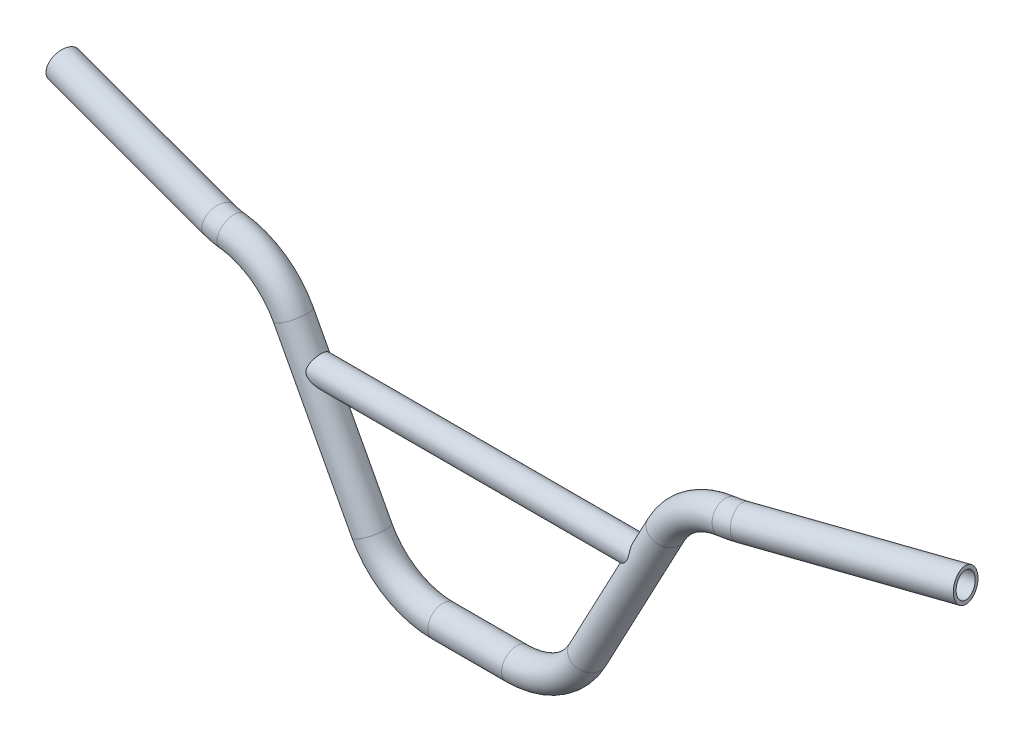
SolidWorks part; units mm, degrees
ref_plane "Plan de face" through (0, 0, 0) normal (0, 0, 1) x (1, 0, 0)
ref_plane "Plan de dessus" through (0, 0, 0) normal (0, 1, 0) x (1, 0, 0)
ref_plane "Plan de droite" through (0, 0, 0) normal (1, 0, 0) x (0, 0, -1)
sketch "Esquisse1" plane through (0, 0, 0) normal (0, 0, 1) x (1, 0, 0)
  line L0 (-330, 188.2804) -> (-181.1181, 170) construction
  line L1 (-136.3673, 139.2436) -> (-78.9166, 31.1947)
  line L2 (-27, 0) -> (0, 0)
  arc A0 (-181.1181, 170) -> (-136.3673, 139.2436) centre (-188.2839, 111.6391) cw
  arc A1 (-78.9166, 31.1947) -> (-27, 0) centre (-27, 58.7992) ccw
  dimension "D5" = 170
  dimension "D6" = 7
  dimension "D1" = 62
  dimension "D2" = 330
  dimension "D3" = 150
  dimension "D4" = 27
sketch "Esquisse2" plane through (0, 0, 0) normal (1, 0, 0) x (0, 0, -1)
  circle A0 centre (0, 0) radius 11
  circle A1 centre (0, 0) radius 8.5
  dimension "D1" = 22
  dimension "D2" = 2.5
sweep "Balayage1" add profiles "Esquisse2" path "Esquisse1"
sketch "Esquisse4" plane through (0, 0, 0) normal (1, 0, 0) x (0, 0, -1)
  circle A0 centre (0, 115) radius 9.5
  circle A1 centre (0, 115) radius 7
  dimension "D1" = 2.5
  dimension "D2" = 19
  dimension "D3" = 115
extrude "Boss.-Extru.2" add sketch "Esquisse4" against normal up to surface (129.7572 mm away)
ref_plane "Plan1" through (0, 170, 0) normal (0, 1, 0) x (1, 0, 0)
sketch "Esquisse5" plane through (0, 170, 0) normal (0, 1, 0) x (1, 0, 0)
  line L0 (-181.1181, 0) -> (-181.1181, 14.4956)
ref_plane "Plan2" through (17.8734, 145.5669, 0) normal (0.1219, 0.9925, 0) x (0.9925, -0.1219, 0)
sketch "Esquisse6" plane through (17.8734, 145.5669, 0) normal (0.1219, 0.9925, 0) x (0.9925, -0.1219, 0)
  line L0 (-350.4858, 25.5235) -> (-210.9047, 0.9115)
  line L2 (-350.4858, 0) -> (-200.4858, 0) construction
  line L3 (-350.4858, 0) -> (-200.4858, 0) construction
  arc A0 (-210.9047, 0.9115) -> (-200.4858, 0) centre (-200.4858, 60) ccw
  dimension "D2" = 60
  dimension "D1" = 10
sketch "Esquisse7" plane through (-198.9914, 24.4331, 0) normal (-0.9925, 0.1219, 0) x (0, 0, 1)
  circle A0 centre (0, 146.6601) radius 8.5 construction
  circle A1 centre (0, 146.6601) radius 11
  circle A2 centre (0, 146.6601) radius 11
  circle A3 centre (0, 146.6601) radius 8.5
  dimension "D1" = 0
sweep "Balayage2" add profiles "Esquisse7" path "Esquisse6"
mirror "Symétrie1" about plane through (0, 0, 0) normal (1, 0, 0) of "Balayage2", "Balayage1", "Boss.-Extru.2"
sketch "Esquisse8" plane through (0, 0, 0) normal (0, 0, 1) x (1, 0, 0)
  line L0 (-331.8959, 188.5132) -> (331.8959, 188.5132) construction
  ellipse E0 centre (-330, 188.2804) end of major axis (-328.6594, 199.1984) minor radius 1.9101 construction
  ellipse E1 centre (330, 188.2804) end of major axis (328.6594, 199.1984) minor radius 1.9101 construction
  point P0 (0, 188.5132)
